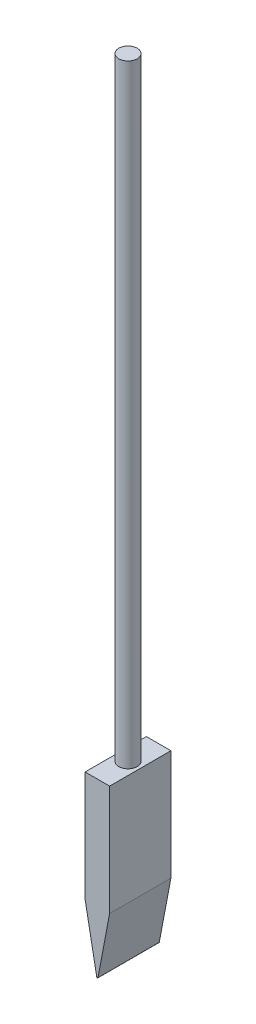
SolidWorks part; units mm, degrees
ref_plane "Front" through (0, 0, 0) normal (0, 0, 1) x (1, 0, 0)
ref_plane "Top" through (0, 0, 0) normal (0, 1, 0) x (1, 0, 0)
ref_plane "Right" through (0, 0, 0) normal (1, 0, 0) x (0, 0, -1)
sketch "Sketch1" plane through (0, 0, 0) normal (0, 0, 1) x (1, 0, 0)
  line L0 (0, 0) -> (0, 28) construction
  line L1 (-2, 10) -> (-0.0982, -0.0186)
  line L2 (-2, 10) -> (-2, 28)
  line L3 (-2, 28) -> (2, 28)
  line L4 (2, 10) -> (0.0982, -0.0186)
  line L5 (2, 10) -> (2, 28)
  arc A0 (-0.0982, -0.0186) -> (0.0982, -0.0186) centre (0, 0) ccw
  dimension "D1" = 18
  dimension "D2" = 10
  dimension "D3" = 4
extrude "Extrude1" add sketch "Sketch1" along normal blind 10
sketch "Sketch2" plane through (0, 28, 0) normal (0, 1, 0) x (-1, 0, 0)
  line L0 (-2, 0) -> (2, 10) construction
  circle A0 centre (0, 5) radius 1.5
extrude "Extrude2" add sketch "Sketch2" along normal blind 100
